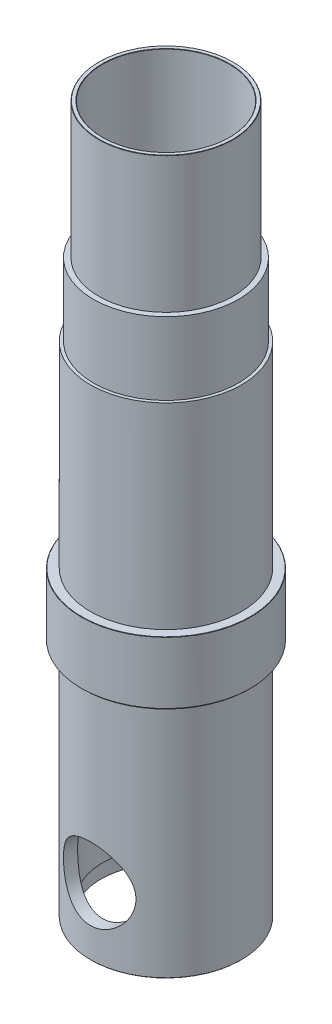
SolidWorks part; units mm, degrees
ref_plane "Спереди" through (0, 0, 0) normal (0, 0, 1) x (1, 0, 0)
ref_plane "Сверху" through (0, 0, 0) normal (0, 1, 0) x (1, 0, 0)
ref_plane "Справа" through (0, 0, 0) normal (1, 0, 0) x (0, 0, -1)
sketch "Эскиз1" plane through (0, 0, 0) normal (0, 1, 0) x (1, 0, 0)
  circle A0 centre (0, 0) radius 25
  circle A1 centre (0, 0) radius 21
  dimension "D1" = 50
  dimension "D2" = 42
extrude "Бобышка-Вытянуть1" add sketch "Эскиз1" along normal blind 65
sketch "Эскиз8" plane through (0, 65, 0) normal (0, 1, 0) x (1, 0, 0)
  circle A0 centre (0, 0) radius 21
  circle A1 centre (0, 0) radius 24
  dimension "D1" = 42
  dimension "D2" = 48
extrude "Бобышка-Вытянуть4" add sketch "Эскиз8" along normal blind 24
sketch "Эскиз10" plane through (0, 0, 0) normal (0, -1, 0) x (1, 0, 0)
  circle A0 centre (0, 0) radius 21
  circle A1 centre (0, 0) radius 28
  dimension "D1" = 42
  dimension "D2" = 56
extrude "Бобышка-Вытянуть6" add sketch "Эскиз10" along normal blind 21
chamfer "Фаска1" distance 0.1 angle 45 1 edges at (0, 0, -28)
sketch "Эскиз12" plane through (0, -21, 0) normal (0, -1, 0) x (1, 0, 0)
  circle A0 centre (0, 0) radius 21
  circle A1 centre (0, 0) radius 25
  dimension "D1" = 42
  dimension "D2" = 50
extrude "Бобышка-Вытянуть7" add sketch "Эскиз12" along normal blind 79
chamfer "Фаска3" distance 0.2 angle 45 1 edges at (0, -100, -25)
sketch "Эскиз13" plane through (0, -100, 0) normal (0, -1, 0) x (1, 0, 0)
  circle A0 centre (0, 0) radius 21.5
  dimension "D1" = 43
extrude "Вырез-Вытянуть1" cut sketch "Эскиз13" against normal blind 5
chamfer "Фаска4" distance 0.1 angle 45 1 edges at (0, -100, -21.5)
sketch "Эскиз14" plane through (0, 0, 0) normal (0, 0, 1) x (1, 0, 0)
  line L1 (-24.8, -100) -> (24.8, -100) construction
  circle A0 centre (0, -78) radius 12
  dimension "D1" = 24
  dimension "D2" = 22
extrude "Вырез-Вытянуть2" cut sketch "Эскиз14" along normal through all
sketch "Эскиз15" plane through (0, 89, 0) normal (0, 1, 0) x (1, 0, 0)
  circle A0 centre (0, 0) radius 22.25
  circle A1 centre (0, 0) radius 21
  dimension "D1" = 44.5
  dimension "D2" = 42
extrude "Бобышка-Вытянуть8" add sketch "Эскиз15" along normal blind 45
chamfer "Фаска5" distance 0.1 angle 45 2 edges at (0, 134, 22.25) (0, 134, 21)
sketch "Эскиз18" plane through (0, -100, 0) normal (0, -1, 0) x (1, 0, 0)
  line L0 (0, 0) -> (0, 28) construction
  line L1 (0, 0) -> (-19.799, 19.799) construction
  line L2 (-18.2561, 18.2703) -> (-15.9672, 15.9813)
  line L3 (-15.9672, 15.9813) -> (-15.9813, 15.9672)
  line L4 (-15.9813, 15.9672) -> (-18.4171, 18.403)
  line L5 (-18.4171, 18.403) -> (-18.2561, 18.2703)
  circle A0 centre (0, 0) radius 28 construction
  dimension "D1" = 45
  dimension "D2" = 0.01
  dimension "D3" = 0.01
extrude "Вырез-Вытянуть8" cut sketch "Эскиз18" against normal blind 0.01
sketch "Эскиз20" plane through (0, 0, 0) normal (0, 0, 1) x (1, 0, 0)
  line L0 (-24.8, -100) -> (24.8, -100) construction
  circle A0 centre (0, -78) radius 12
  dimension "D1" = 24
  dimension "D2" = 22
extrude "Вырез-Вытянуть10" cut sketch "Эскиз20" against normal through all
chamfer "Фаска6" distance 0.5 angle 45 1 edges at (0, -21, -28)
